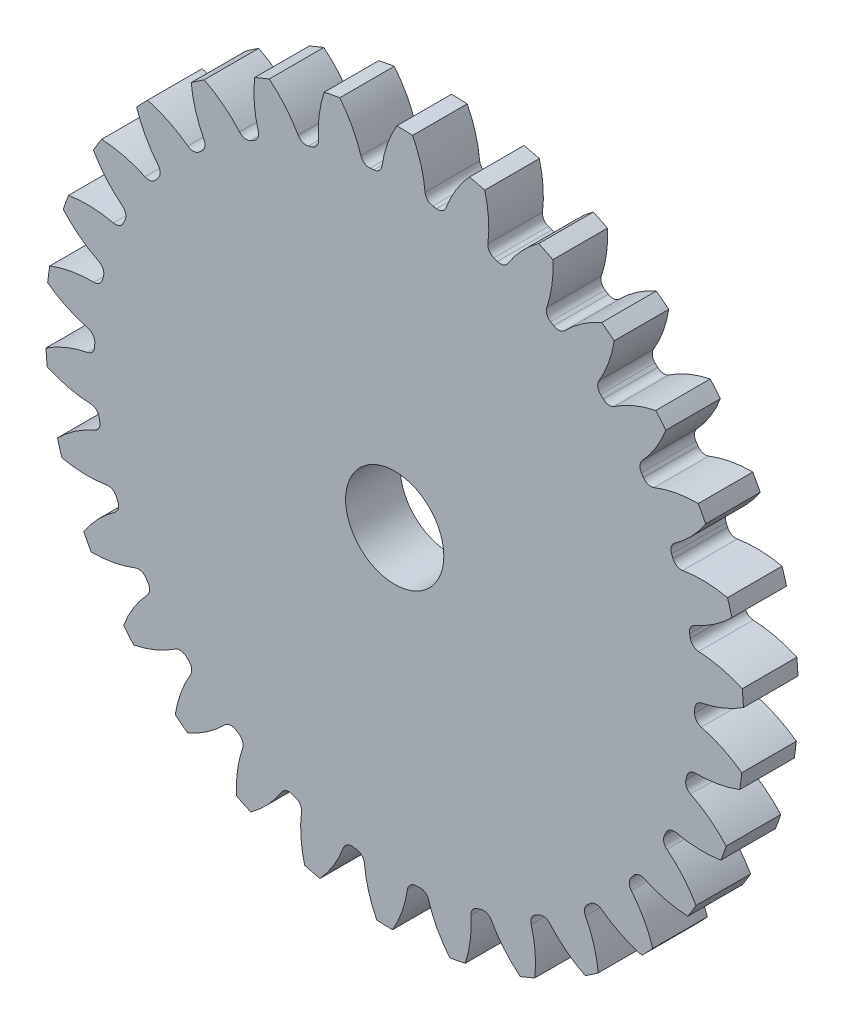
SolidWorks part; units mm, degrees
ref_plane "Front" through (0, 0, 0) normal (0, 0, 1) x (1, 0, 0)
ref_plane "Top" through (0, 0, 0) normal (0, 1, 0) x (1, 0, 0)
ref_plane "Right" through (0, 0, 0) normal (1, 0, 0) x (0, 0, -1)
sketch "Sketch3" plane through (0, 0, 0) normal (0, 0, 1) x (1, 0, 0)
  circle A0 centre (0, 0) radius 812.8
  dimension "od" = 1625.6
extrude "gearBody" add sketch "Sketch3" along normal blind 127
sketch "Sketch2" plane through (0, 0, 0) normal (0, 0, 1) x (1, 0, 0)
  line L0 (0, 0) -> (661.54, 274.0189) construction
  line L1 (808.9196, -90.7923) -> (0, 0) construction
  line L2 (0, 0) -> (36.3143, 0) construction
  line L3 (761.7927, 17.771) -> (759.513, -61.5137) construction
  line L5 (760.6529, -21.8714) -> (0, 0) construction
  line L7 (0, 0) -> (716.0458, 0) construction
  arc A0 (716.0328, 4.3077) -> (714.6023, -45.4433) centre (0, 0) ccw construction
  arc A1 (811.6403, 43.4034) -> (807.8054, -89.968) centre (0, 0) ccw construction
  arc A2 (761.7927, 17.771) -> (759.513, -61.5137) centre (0, 0) ccw construction
  arc A3 (698.0726, -24.4312) -> (698.3231, -15.7199) centre (0, 0) ccw
  arc A4 (808.9196, -90.7923) -> (713.5615, -45.1721) centre (644.7021, -311.5777) ccw
  arc A5 (808.9196, -90.7923) -> (812.8, 44.1624) centre (0, 0) ccw
  arc A6 (812.8, 44.1624) -> (714.9781, 4.0968) centre (661.54, 274.0189) cw
  arc A7 (698.3231, -15.7199) -> (714.9781, 4.0968) centre (718.9935, -16.1852) cw
  arc A8 (713.5615, -45.1721) -> (698.0726, -24.4312) centre (718.7356, -25.1544) cw
  point P6 (812.8, 44.1624)
  point P22 (808.9196, -90.7923)
  dimension "baseDia" = 1432.0916
  dimension "od" = 1625.6
  dimension "pd" = 1524
  dimension "rd" = 1397
  dimension "rFillet" = 20.6756
  dimension "pointX" = 812.8
  dimension "pointY" = 44.1624
  dimension "CTT" = 79.2847
  dimension "flankCenterAngle" = 22.5
extrude "toothCut" cut sketch "Sketch2" along normal through all
pattern_circular "CirPattern1" count 30 over 360 about axis through (0, 0, 0) along (0, 0, 1) of "toothCut"
sketch "hub1Dia" plane through (0, 0, 0) normal (0, 0, -1) x (-1, 0, 0)
  circle A0 centre (0, 0) radius 12.7
  dimension "hub1Dia" = 25.4
sketch "hub2Dia" plane through (0, 0, 127) normal (0, 0, 1) x (1, 0, 0)
  circle A0 centre (0, 0) radius 12.7
  dimension "hub2dia" = 25.4
sketch "boreDia" plane through (0, 0, 0) normal (0, 0, 1) x (1, 0, 0)
  circle A0 centre (0, 0) radius 114.3
  dimension "boreDia" = 228.6
extrude "bore" cut sketch "boreDia" against normal mid plane 25400
